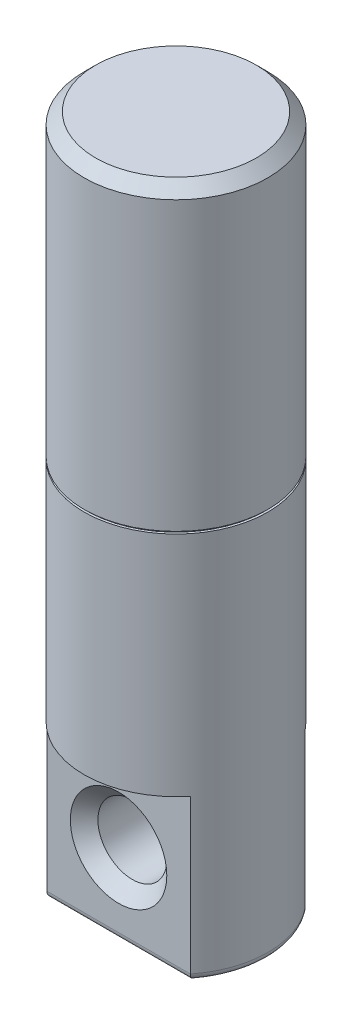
SolidWorks part; units mm, degrees
ref_plane "Front" through (0, 0, 0) normal (0, 0, 1) x (1, 0, 0)
ref_plane "Top" through (0, 0, 0) normal (0, 1, 0) x (1, 0, 0)
ref_plane "Right" through (0, 0, 0) normal (1, 0, 0) x (0, 0, -1)
sketch "Sketch1" plane through (0, 0, 0) normal (0, 1, 0) x (1, 0, 0)
  circle A0 centre (0, 0) radius 2
  dimension "D1" = 4
extrude "Extrude1" add sketch "Sketch1" along normal blind 15
chamfer "Chamfer1" distance 0.25 angle 45 1 edges at (0, 15, 2)
sketch "Sketch2" plane through (0, 0, 0) normal (0, -1, 0) x (1, 0, 0)
  line L0 (1.5612, -1.25) -> (-1.5612, -1.25)
  arc A0 (-1.5612, -1.25) -> (1.5612, -1.25) centre (0, 0) ccw
  circle A1 centre (0, 0) radius 2 construction
  dimension "D1" = 1.25
extrude "Cut-Extrude1" cut sketch "Sketch2" against normal blind 3.5
mirror "Mirror1" about plane through (0, 0, 0) normal (0, 0, 1) of "Cut-Extrude1"
sketch "Sketch3" plane through (0, 0, 0) normal (0, 0, 1) x (1, 0, 0)
  line L0 (2, 0) -> (2, 14.75) construction
  line L1 (1.95, 8.5) -> (2.3207, 8.5)
  line L2 (1.95, 8.5) -> (1.95, 8.45)
  line L3 (1.95, 8.45) -> (2.3207, 8.45)
  line L4 (2.3207, 8.5) -> (2.3207, 8.45)
  line L5 (-1.5612, 3.5) -> (1.5612, 3.5) construction
  line L6 (0, 0) -> (0, 7.3892) construction
  dimension "D1" = 0.05
  dimension "D2" = 0.05
  dimension "D3" = 5
revolve "Cut-Revolve1" cut sketch "Sketch3" angle 360 about L6
sketch "Sketch4" plane through (0, 0, 0) normal (0, 0, 1) x (1, 0, 0)
  circle A0 centre (0, 1.75) radius 0.75
  dimension "D1" = 1.5
  dimension "D2" = 1.75
extrude "Cut-Extrude2" cut sketch "Sketch4" against normal through all and the other way through all
chamfer "Chamfer2" distance 0.3 angle 45 2 edges at (0.75, 1.75, -1.25) (0.75, 1.75, 1.25)
fillet "Fillet1" radius 0.15 4 edges at (-2, 0, 0) (2, 0, 0) (0, 0, -1.25) (0, 0, 1.25)
